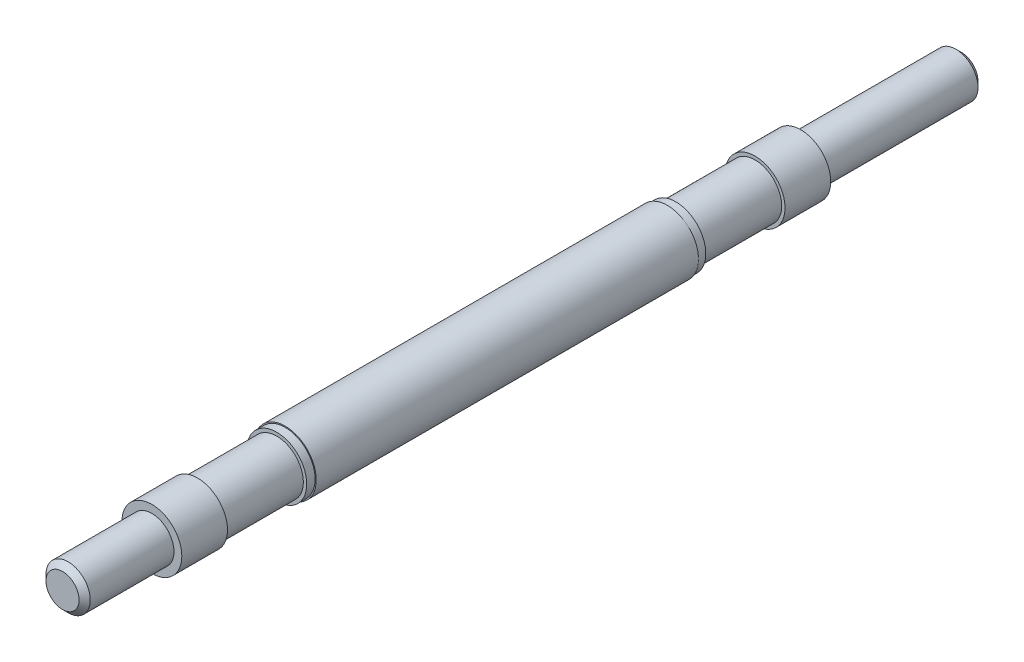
SolidWorks part; units mm, degrees
ref_plane "Plan de face" through (0, 0, 0) normal (0, 0, 1) x (1, 0, 0)
ref_plane "Plan de dessus" through (0, 0, 0) normal (0, 1, 0) x (1, 0, 0)
ref_plane "Plan de droite" through (0, 0, 0) normal (1, 0, 0) x (0, 0, -1)
sketch "Esquisse1" plane through (0, 0, 0) normal (0, 0, 1) x (1, 0, 0)
  circle A0 centre (0, 0) radius 11.1
  dimension "D1" = 22.2
extrude "Matiere de depart" add sketch "Esquisse1" along normal mid plane 321
sketch "Esquisse2" plane through (0, 0, 160.5) normal (0, 0, 1) x (1, 0, 0)
  circle A0 centre (0, 0) radius 10.7
  circle A1 centre (0, 0) radius 11.1
  circle A2 centre (0, 0) radius 11.1 construction
  dimension "D1" = 21.4
extrude "Chariotage D21.40*79.50" cut sketch "Esquisse2" against normal blind 79.5
sketch "Esquisse3" plane through (0, 0, -160.5) normal (0, 0, -1) x (-1, 0, 0)
  circle A0 centre (0, 0) radius 11.1
  circle A1 centre (0, 0) radius 10.7
  circle A2 centre (0, 0) radius 11.1 construction
  dimension "D1" = 21.4
extrude "Chariotage D21.40*105" cut sketch "Esquisse3" against normal blind 105
sketch "Esquisse4" plane through (0, 0, 160.5) normal (0, 0, 1) x (1, 0, 0)
  circle A0 centre (0, 0) radius 7.9
  circle A1 centre (0, 0) radius 10.7
  circle A2 centre (0, 0) radius 10.7 construction
  dimension "D1" = 15.8
extrude "Chariotage D15.80*31.90" cut sketch "Esquisse4" against normal blind 31.9
sketch "Esquisse5" plane through (0, 0, -160.5) normal (0, 0, -1) x (-1, 0, 0)
  circle A0 centre (0, 0) radius 7.9
  circle A1 centre (0, 0) radius 10.7
  circle A2 centre (0, 0) radius 10.7 construction
  dimension "D1" = 15.8
extrude "Chariotage D15.80*57.40" cut sketch "Esquisse5" against normal blind 57.4
chamfer "Chanfrein 2*45°" distance 2 angle 45 2 edges at (-7.9, 0, -160.5) (7.9, 0, 160.5)
ref_plane "Plan1" through (0, 0, 112.3) normal (0, 0, 1) x (1, 0, 0)
sketch "Esquisse6" plane through (0, 0, 112.3) normal (0, 0, 1) x (1, 0, 0)
  circle A0 centre (0, 0) radius 9.5
  circle A1 centre (0, 0) radius 10.7
  circle A2 centre (0, 0) radius 10.7 construction
  dimension "D1" = 19
extrude "Chariotage D19*28.30" cut sketch "Esquisse6" against normal blind 28.3
ref_plane "Plan2" through (0, 0, -86.8) normal (0, 0, -1) x (-1, 0, 0)
sketch "Esquisse7" plane through (0, 0, -86.8) normal (0, 0, -1) x (-1, 0, 0)
  circle A0 centre (0, 0) radius 10.7
  circle A1 centre (0, 0) radius 9.5
  circle A2 centre (0, 0) radius 10.7 construction
  dimension "D1" = 19
extrude "Chariotage D19*28.30'" cut sketch "Esquisse7" against normal blind 28.3
ref_plane "Plan3" through (0, -6.3, 0) normal (0, 1, 0) x (1, 0, 0)
